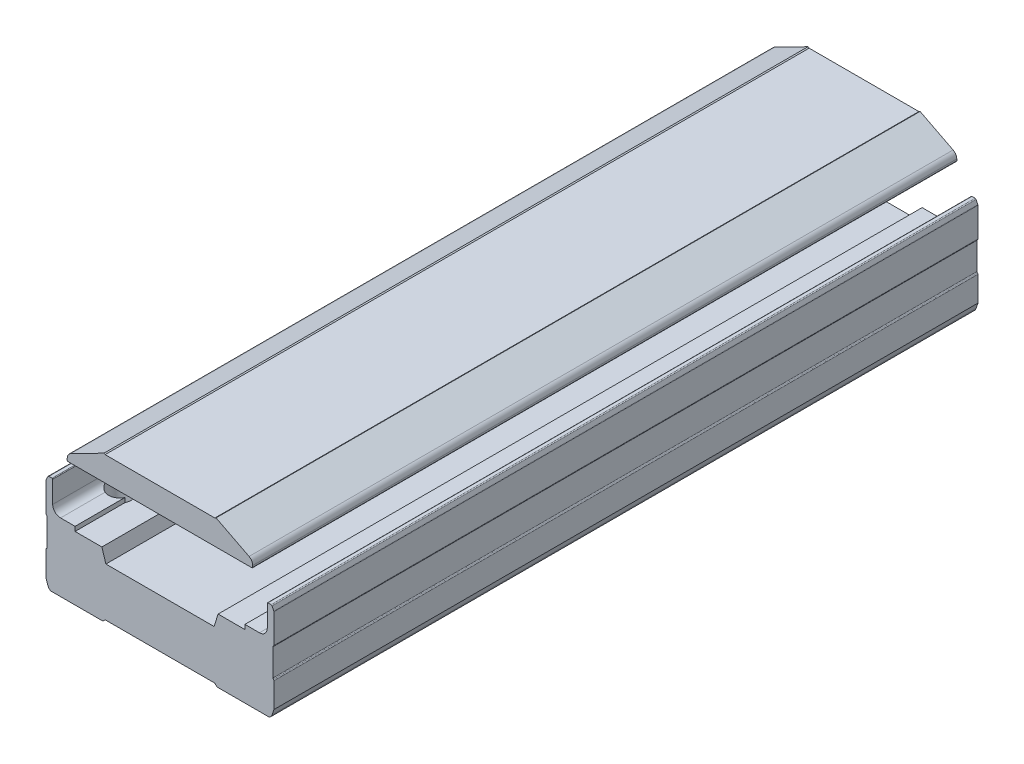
SolidWorks part; units mm, degrees
ref_plane "前视基准面" through (0, 0, 0) normal (0, 0, 1) x (1, 0, 0)
ref_plane "上视基准面" through (0, 0, 0) normal (0, 1, 0) x (1, 0, 0)
ref_plane "右视基准面" through (0, 0, 0) normal (1, 0, 0) x (0, 0, -1)
sketch "草图1" plane through (0, 0, 0) normal (0, 0, 1) x (1, 0, 0)
  line B0 (41.5, 53.4) -> (41.5, 54.0916)
  line B1 (39.862, 56.7646) -> (25.073, 64.3)
  line B2 (25.073, 64.3) -> (24.5533, 64)
  line B3 (24.5533, 64) -> (-24.5533, 64)
  line B4 (-24.5533, 64) -> (-25.073, 64.3)
  line B5 (-25.073, 64.3) -> (-39.862, 56.7646)
  line B6 (-41.5, 54.0916) -> (-41.5, 53.4)
  line B7 (-41.1, 53) -> (41.1, 53)
  line B8 (-24.1966, 21.7805) -> (-26, 27.5)
  line B9 (-26, 27.5) -> (-38, 27.5)
  line B10 (-38, 27.5) -> (-38, 29.5)
  line B11 (-38, 29.5) -> (-44.5, 29.5)
  line B12 (-48, 33) -> (-48, 42.7)
  line B13 (-48.3, 43) -> (-49.691, 43)
  line B14 (-50.1382, 42.7236) -> (-50.9472, 41.1056)
  line B15 (-51, 40.882) -> (-51, 27.866)
  line B16 (-50.5, 27) -> (-50.5, 15)
  line B17 (-51, 14.134) -> (-51, 3)
  line B18 (-51, 3) -> (-50.1378, 0.496)
  line B19 (-49, -1) -> (-25.5, -1)
  line B20 (-25.5, -1) -> (-24.5, 0)
  line B21 (-24.5, 0) -> (24.5, 0)
  line B22 (24.5, 0) -> (25.5, -1)
  line B23 (25.5, -1) -> (49, -1)
  line B24 (50.1378, 0.496) -> (51, 3)
  line B25 (51, 3) -> (51, 14.134)
  line B26 (50.5, 15) -> (50.5, 27)
  line B27 (51, 27.866) -> (51, 40.882)
  line B28 (50.9472, 41.1056) -> (50.1382, 42.7236)
  line B29 (49.691, 43) -> (48.3, 43)
  line B30 (48, 42.7) -> (48, 33)
  line B31 (44.5, 29.5) -> (38, 29.5)
  line B32 (38, 29.5) -> (38, 27.5)
  line B33 (38, 27.5) -> (26, 27.5)
  line B34 (26, 27.5) -> (24.1966, 21.7805)
  line B35 (24.1966, 21.7805) -> (-24.1966, 21.7805)
  arc B36 (41.1, 53) -> (41.5, 53.4) centre (41.1, 53.4) ccw
  arc B37 (41.5, 54.0916) -> (39.862, 56.7646) centre (38.5, 54.0916) ccw
  arc B38 (-39.862, 56.7646) -> (-41.5, 54.0916) centre (-38.5, 54.0916) ccw
  arc B39 (-41.5, 53.4) -> (-41.1, 53) centre (-41.1, 53.4) ccw
  arc B40 (-48, 33) -> (-44.5, 29.5) centre (-44.5, 33) ccw
  arc B41 (-48, 42.7) -> (-48.3, 43) centre (-48.3, 42.7) ccw
  arc B42 (-49.691, 43) -> (-50.1382, 42.7236) centre (-49.691, 42.5) ccw
  arc B43 (-50.9472, 41.1056) -> (-51, 40.882) centre (-50.5, 40.882) ccw
  arc B44 (-51, 27.866) -> (-50.75, 27.433) centre (-50.5, 27.866) ccw
  arc B45 (-50.5, 27) -> (-50.75, 27.433) centre (-51, 27) ccw
  arc B46 (-50.75, 14.567) -> (-50.5, 15) centre (-51, 15) ccw
  arc B47 (-50.75, 14.567) -> (-51, 14.134) centre (-50.5, 14.134) ccw
  arc B48 (-50.1378, 0.496) -> (-49, -1) centre (-47.3012, 1.4727) ccw
  arc B49 (49, -1) -> (50.1378, 0.496) centre (47.3012, 1.4727) ccw
  arc B50 (51, 14.134) -> (50.75, 14.567) centre (50.5, 14.134) ccw
  arc B51 (50.5, 15) -> (50.75, 14.567) centre (51, 15) ccw
  arc B52 (50.75, 27.433) -> (50.5, 27) centre (51, 27) ccw
  arc B53 (50.75, 27.433) -> (51, 27.866) centre (50.5, 27.866) ccw
  arc B54 (51, 40.882) -> (50.9472, 41.1056) centre (50.5, 40.882) ccw
  arc B55 (50.1382, 42.7236) -> (49.691, 43) centre (49.691, 42.5) ccw
  arc B56 (48.3, 43) -> (48, 42.7) centre (48.3, 42.7) ccw
  arc B57 (44.5, 29.5) -> (48, 33) centre (44.5, 33) ccw
sketch_block_instance "块1-1"
sketch_block "块1"
extrude "凸台-拉伸1" add sketch "草图1" along normal blind 315
hole_wizard "打孔尺寸(%根据)内六角圆柱头螺钉的类型1" positions "草图7" profile "草图5" counterbore size "M5" standard "GB"
sketch "草图7" plane through (0, 43, 0) normal (0, 1, 0) x (1, 0, 0)
  line L0 (0, 0) -> (0, -383.8232) construction
  line L1 (-25.073, 0) -> (-39.862, 0) construction
  point P0 (-42.5, -40.5)
  point P8 (-42.5, -90.5)
  point P10 (-42.5, -890.5)
  point P12 (-42.5, -490.5)
  point P14 (-42.5, -290.5)
  point P16 (-42.5, -1090.5)
  point P18 (-42.5, -690.5)
  point P34 (42.5, -690.5)
  point P35 (42.5, -1090.5)
  point P36 (42.5, -290.5)
  point P37 (42.5, -490.5)
  point P38 (42.5, -890.5)
  point P39 (42.5, -90.5)
  point P40 (42.5, -40.5)
  dimension "D1" = 85
  dimension "D2" = 40.5
  dimension "D3" = 50
  dimension "D4" = 200
  dimension "D5" = 200
  dimension "D6" = 200
  dimension "D7" = 200
  dimension "D8" = 200
sketch "草图5" plane through (-42.5, 43, 40.5) normal (1, 0, 0) x (0, 0, 1)
  line L0 (0, 0) -> (0, 44)
  line L1 (0, 44) -> (2.75, 44)
  line L3 (2.75, 44) -> (2.75, 30.5)
  line L4 (2.75, 30.5) -> (5, 30.5)
  line L5 (5, 30.5) -> (5, 0)
  line L7 (5, 0) -> (0, 0)
  line L11 (0, -6.35) -> (0, 107.95) construction
  dimension "通孔孔直径" = 5.5
  dimension "通孔孔深度" = 44
  dimension "柱形沉头孔直径" = 10
  dimension "柱形沉头孔深度" = 30.5
hole_wizard "M5 螺纹孔1" positions "草图8" profile "草图9" tap size "M5" standard "GB"
sketch "草图8" plane through (0, -1, 0) normal (0, -1, 0) x (-1, 0, 0)
  line L0 (0, 0) -> (0, -43.6644) construction
  line L1 (-25.5, 0) -> (-49, 0) construction
  point P0 (-42.5, -30.5)
  point P7 (42.5, -30.5)
  point P10 (-42.5, -80.5)
  point P12 (-42.5, -280.5)
  point P14 (-42.5, -480.5)
  point P18 (-42.5, -680.5)
  point P20 (-42.5, -880.5)
  point P21 (42.5, -880.5)
  point P22 (42.5, -680.5)
  point P23 (42.5, -480.5)
  point P24 (42.5, -280.5)
  point P25 (42.5, -80.5)
  dimension "D1" = 85
  dimension "D2" = 30.5
  dimension "D3" = 50
  dimension "D4" = 200
  dimension "D5" = 200
  dimension "D6" = 200
  dimension "D7" = 200
sketch "草图9" plane through (42.5, -1, 30.5) normal (1, 0, 0) x (0, 0, -1)
  line L0 (0, 0) -> (0, 12.2618)
  line L1 (0, 12.2618) -> (2.1, 11)
  line L2 (2.1, 11) -> (2.1, 0)
  line L5 (2.1, 0) -> (0, 0)
  line L10 (0, 12.2618) -> (-2.1, 11) construction
  line L11 (0, -6.35) -> (0, 107.95) construction
  dimension "螺纹孔钻头直径" = 4.2
  dimension "螺纹孔钻头深度" = 11
  dimension "导头角度" = 118
